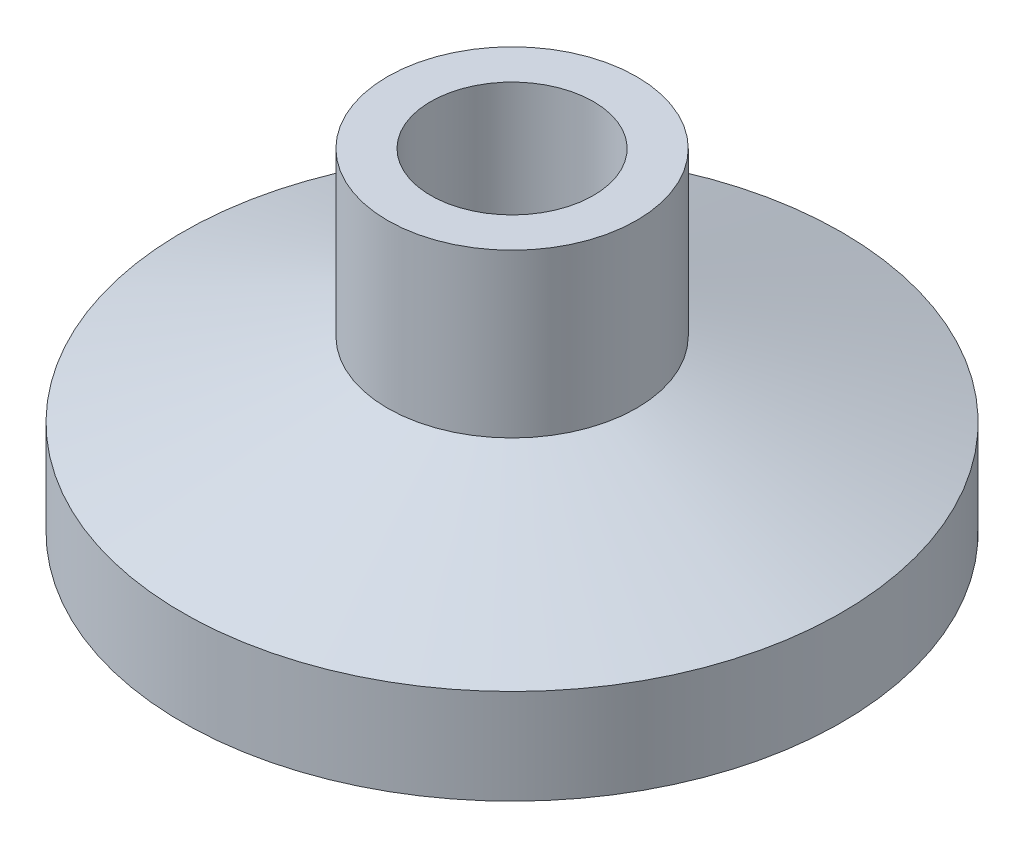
SolidWorks part; units mm, degrees
ref_plane "Front Plane" through (0, 0, 0) normal (0, 0, 1) x (1, 0, 0)
ref_plane "Top Plane" through (0, 0, 0) normal (0, 1, 0) x (1, 0, 0)
ref_plane "Right Plane" through (0, 0, 0) normal (1, 0, 0) x (0, 0, -1)
sketch "Sketch1" plane through (0, 0, 0) normal (0, 0, 1) x (1, 0, 0)
  line L0 (-3.1115, 0.889) -> (-3.1115, 12.7)
  line L1 (-3.1115, 12.7) -> (-4.7625, 12.7)
  line L2 (-4.7625, 12.7) -> (-4.7625, 6.4842)
  line L3 (-4.7625, 6.4842) -> (-12.5984, 3.6322)
  line L4 (-12.5984, 3.6322) -> (-12.5984, 0)
  line L5 (-12.5984, 0) -> (-10.922, 0)
  line L6 (-10.922, 0) -> (-10.922, 1.3208)
  line L7 (0, 0) -> (0, 14.3564) construction
  line L9 (-8.6024, 0.889) -> (-3.1115, 0.889)
  line L10 (-9.5843, 1.853) -> (-8.6024, 0.889)
  arc A2 (-9.5843, 1.853) -> (-10.922, 1.3208) centre (-10.1473, 1.3208) ccw
  dimension "D7" = 10.1473
  dimension "D1" = 12.7
  dimension "D2" = 3.6322
  dimension "D3" = 20
  dimension "D4" = 3.1115
  dimension "D5" = 4.7625
  dimension "D6" = 11.811
  dimension "D8" = 10.922
  dimension "D9" = 12.5984
  dimension "D10" = 8.6024
revolve "Revolve1" add sketch "Sketch1" angle 360 about L7
